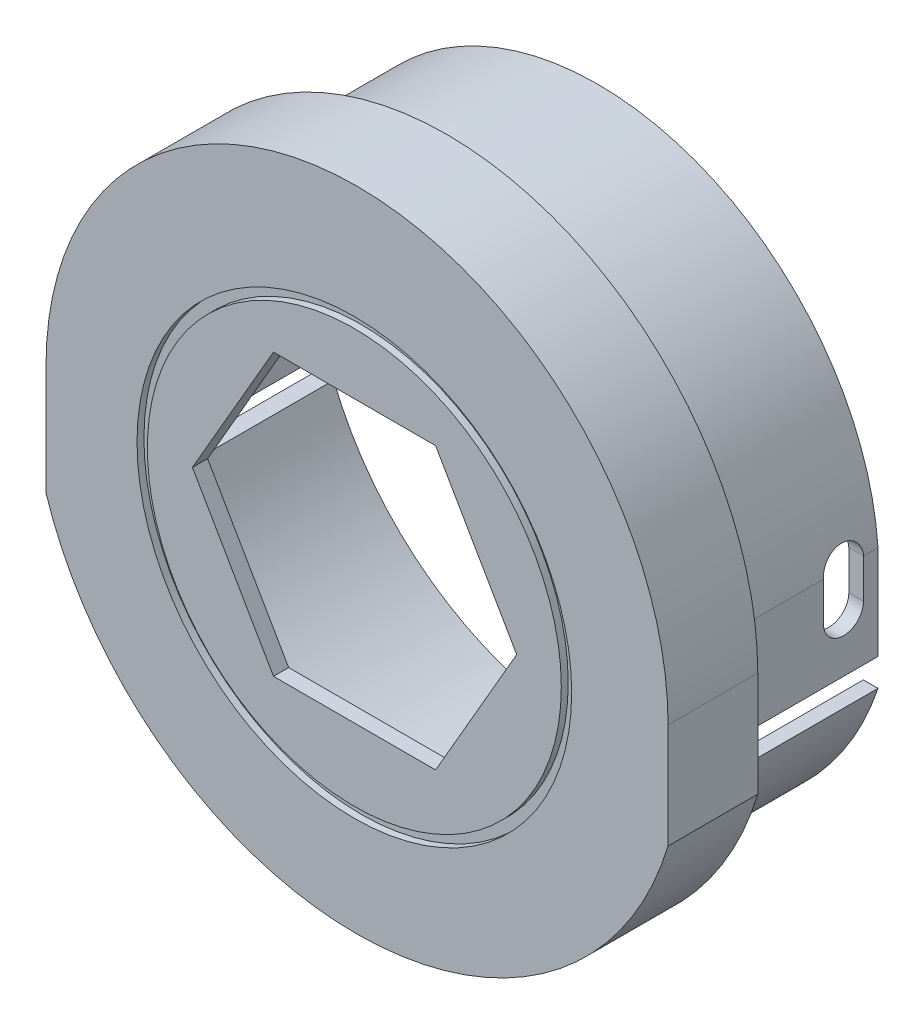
SolidWorks part; units mm, degrees
ref_plane "Front Plane" through (0, 0, 0) normal (0, 0, 1) x (1, 0, 0)
ref_plane "Top Plane" through (0, 0, 0) normal (0, 1, 0) x (1, 0, 0)
ref_plane "Right Plane" through (0, 0, 0) normal (1, 0, 0) x (0, 0, -1)
sketch "草图1" plane through (0, 0, 0) normal (0, 0, 1) x (1, 0, 0)
  line L16 (-23.2207, -1.2625) -> (-23.2207, -9.2462)
  line L18 (21.8612, -1.2625) -> (21.8612, -8.8618)
  arc A5 (-23.2207, -1.2625) -> (21.8612, -1.2625) centre (-0.6797, -1.2625) cw
  arc A6 (-23.2207, -9.2462) -> (21.8612, -8.8618) centre (-0.7393, -2.0647) ccw
extrude "凸台-拉伸1" add sketch "草图1" along normal blind 1.5
sketch "草图2" plane through (0, 0, 0) normal (0, 0, -1) x (-1, 0, 0)
  line L7 (-10.89, -2.3374) -> (-5.015, -12.5132)
  line L8 (-5.015, -12.5132) -> (6.735, -12.5132)
  line L9 (6.735, -12.5132) -> (12.61, -2.3374)
  line L10 (12.61, -2.3374) -> (6.735, 7.8384)
  line L11 (6.735, 7.8384) -> (-5.015, 7.8384)
  line L12 (-5.015, 7.8384) -> (-10.89, -2.3374)
  circle A1 centre (0.86, -2.3374) radius 10.1758 construction
extrude "切除-拉伸1" cut sketch "草图2" against normal blind 1.5
sketch "草图11" plane through (0, 0, 1.5) normal (0, 0, 1) x (1, 0, 0)
  circle A0 centre (-0.8747, -2.7494) radius 15
  circle A1 centre (-0.8747, -2.7494) radius 15.75
  dimension "D1" = 0.75
extrude "切除-拉伸12" cut sketch "草图11" against normal blind 0.5
sketch "草图20" plane through (0, 0, 0) normal (0, 0, -1) x (-1, 0, 0)
  line L1 (-18.5112, -8.8618) -> (-18.5112, -0.0325)
  line L2 (19.8704, -0.3844) -> (19.8704, -9.2462)
  line L4 (-19.5747, -0.0325) -> (-19.5747, -8.8618)
  line L5 (21.066, -0.3844) -> (21.066, -9.2462)
  arc A0 (-18.5112, -0.0325) -> (19.8704, -0.3844) centre (0.6676, -1.5127) cw
  arc A1 (-18.5112, -8.8618) -> (19.8704, -9.2462) centre (0.7537, -1.6484) ccw
  arc A4 (-19.5747, -0.0325) -> (21.066, -0.3844) centre (0.7348, -1.458) cw
  arc A5 (-19.5747, -8.8618) -> (21.066, -9.2462) centre (0.8114, -2.0968) ccw
  dimension "D2" = 0
  dimension "D4" = 0
  dimension "D5" = 3.35
extrude "凸台-拉伸2" add sketch "草图20" along normal blind 16
sketch "草图21" plane through (0, 0, 0) normal (0, 0, -1) x (-1, 0, 0)
  line L0 (-21.8612, -1.2625) -> (-21.8612, -8.8618)
  line L1 (-21.2442, -8.8618) -> (-21.2442, -1.2625)
  line L2 (22.428, -1.2625) -> (22.428, -9.2462)
  line L3 (23.2207, -1.2625) -> (23.2207, -9.2462)
  arc A0 (-21.8612, -1.2625) -> (23.2207, -1.2625) centre (0.6797, -1.2625) cw
  arc A1 (-21.8612, -8.8618) -> (23.2207, -9.2462) centre (0.7393, -2.0647) ccw
  arc A2 (-21.2442, -1.2625) -> (22.428, -1.2625) centre (0.5919, -1.7238) cw
  arc A3 (-21.2442, -8.8618) -> (22.428, -9.2462) centre (0.6576, -1.5849) ccw
extrude "凸台-拉伸3" add sketch "草图21" along normal blind 5
sketch "草图22" plane through (0, 0, -16) normal (0, 0, -1) x (-1, 0, 0)
  line L0 (-19.5747, -0.0325) -> (-19.5747, -8.8618) construction
  line L1 (-19.5747, -6.8618) -> (-18.5112, -6.8618)
  line L2 (-19.5747, -6.8618) -> (-19.5747, -8.8618)
  line L3 (-19.5747, -8.8618) -> (-18.5112, -8.8618)
  line L4 (-18.5112, -6.8618) -> (-18.5112, -8.8618)
  line L5 (-18.5112, -0.0325) -> (-18.5112, -8.8618) construction
  line L6 (-18.5112, -0.0325) -> (-18.5112, -8.8618) construction
  line L12 (19.8704, -9.2462) -> (19.8704, -0.3844) construction
  line L13 (21.066, -9.2462) -> (19.8704, -9.2462)
  line L14 (21.066, -9.2462) -> (21.066, -7.2462)
  line L15 (21.066, -7.2462) -> (19.8704, -7.2462)
  line L16 (19.8704, -9.2462) -> (19.8704, -7.2462)
  dimension "D1" = 2
  dimension "D2" = 2
extrude "切除-拉伸13" cut sketch "草图22" against normal blind 11
sketch "草图23" plane through (19.5747, 0, 0) normal (1, 0, 0) x (0, 0, -1)
  line L0 (16, -0.0325) -> (0, -0.0325) construction
  line L1 (16, -0.0325) -> (16, -6.8618) construction
  line L3 (12.05, -0.0325) -> (12.05, -2.8618)
  line L4 (14.95, -2.8618) -> (14.95, -0.0325)
  arc A1 (12.05, -2.8618) -> (14.95, -2.8618) centre (13.5, -2.8618) ccw
  arc A2 (12.05, -0.0325) -> (14.95, -0.0325) centre (13.5, -0.0325) cw
  dimension "D1" = 2.5
extrude "切除-拉伸14" cut sketch "草图23" against normal blind 3
sketch "草图24" plane through (-21.066, 0, 0) normal (-1, 0, 0) x (0, 0, 1)
  line L0 (1.5, -1.2625) -> (1.5, -9.2462) construction
  line L1 (-5, -7.2462) -> (-16, -7.2462) construction
  circle A0 centre (-13.5, -1.2462) radius 1.45
  dimension "D1" = 15
  dimension "D2" = 6
extrude "切除-拉伸15" cut sketch "草图24" against normal blind 3
sketch "草图25" plane through (0, 0, 0) normal (0, 0, -1) x (-1, 0, 0)
  line L0 (-13.2716, -2.6335) -> (-6.7297, 9.4613)
  line L1 (8.1247, 9.7952) -> (14.7429, -2.1061)
  line L2 (7.7173, -14.703) -> (-5.8844, -14.703)
  arc A0 (-6.7297, 9.4613) -> (8.1247, 9.7952) centre (0.9396, -1.1458) cw
  arc A1 (14.7429, -2.1061) -> (7.7173, -14.703) centre (1.4112, -2.9282) cw
  arc A2 (-5.8844, -14.703) -> (-13.2716, -2.6335) centre (0.6153, -2.4293) cw
  dimension "D1" = 2.4
  dimension "D2" = 2.4
  dimension "D3" = 2.4
extrude "切除-拉伸16" cut sketch "草图25" against normal blind 0.4
sketch "草图26" plane through (0, 0, 0) normal (0, 0, -1) x (-1, 0, 0)
  line L0 (-19.5747, -0.0325) -> (-19.5747, -6.8618) construction
  line L1 (21.066, -7.2462) -> (21.066, -0.3844) construction
  line L2 (-21.2442, -1.2625) -> (-21.2442, -8.8618)
  line L3 (-19.5747, -1.2625) -> (-19.5747, -8.8618)
  line L4 (21.066, -1.2625) -> (21.066, -9.2462)
  line L5 (22.428, -1.2625) -> (22.428, -9.2462)
  arc A0 (-21.2442, -1.2625) -> (22.428, -1.2625) centre (0.5919, -1.7238) cw
  arc A1 (-21.2442, -8.8618) -> (22.428, -9.2462) centre (0.6576, -1.5849) ccw
  arc A2 (-19.5747, -8.8618) -> (21.066, -9.2462) centre (0.8114, -2.0968) ccw
  arc A3 (-19.5747, -1.2625) -> (21.066, -1.2625) centre (0.7456, -1.421) cw
extrude "切除-拉伸17" cut sketch "草图26" against normal blind 1.15
